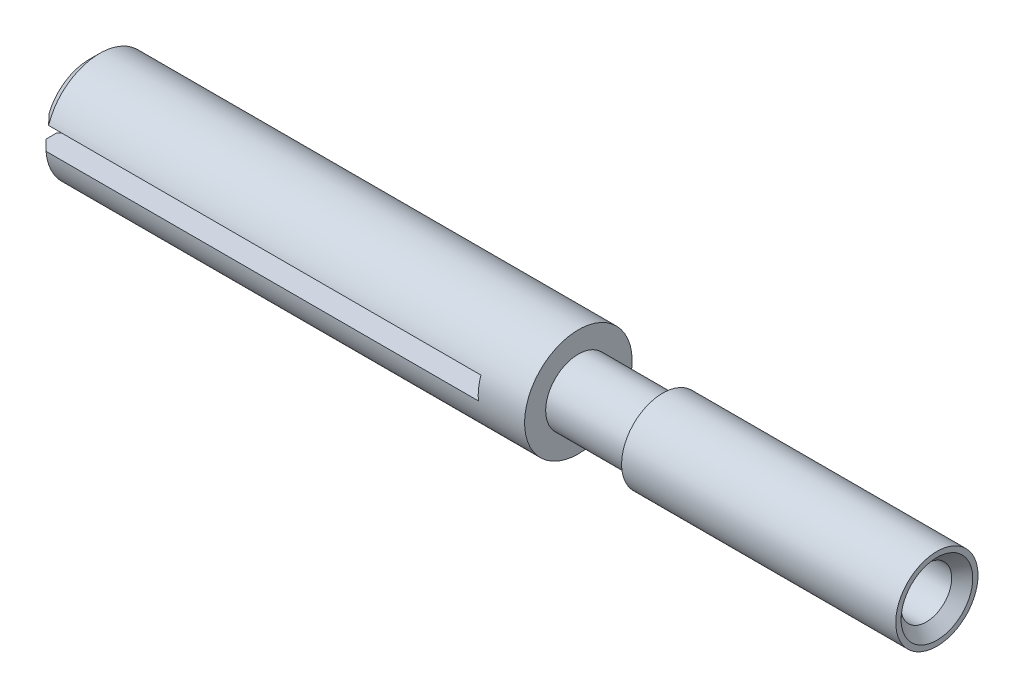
SolidWorks part; units mm, degrees
ref_plane "Plan1" through (0, 0, 0) normal (0, 0, 1) x (1, 0, 0)
ref_plane "Plan2" through (0, 0, 0) normal (0, 1, 0) x (1, 0, 0)
ref_plane "Plan3" through (0, 0, 0) normal (1, 0, 0) x (0, 0, -1)
sketch "Esquisse1" plane through (0, 0, 0) normal (0, 0, 1) x (1, 0, 0)
  line L0 (-28.7, 1.75) -> (-28.7, 1.25)
  line L1 (-5.5, 2.25) -> (-5.5, 1.25)
  line L2 (-5.5, 1.25) -> (-1.5, 1.25)
  line L3 (-1.5, 1.25) -> (-1.5, 1.65)
  line L4 (-1.5, 1.65) -> (-0.6, 1.65)
  line L5 (11.5, 1.65) -> (11.5, 1.4)
  line L6 (11.5, 1.4) -> (11, 0.9)
  line L7 (11, 0.9) -> (0, 0.9)
  line L8 (0, 0.9) -> (-0.5, 0)
  line L9 (-0.5, 0) -> (-6.2, 0)
  line L10 (-28.7, 1.25) -> (-28.2, 0.75)
  line L11 (-28.2, 0.75) -> (-6.7, 0.75)
  line L12 (-6.7, 0.75) -> (-6.2, 0)
  line L13 (-0.6, 1.65) -> (11.5, 1.65)
  line L14 (-57.7, -0.3) -> (56.3, -0.3) construction
  line L15 (-28.2, 2.25) -> (-28.7, 1.75)
  line L16 (-28.2, 2.25) -> (-5.5, 2.25)
  dimension "D13" = 0.5
  dimension "D1" = 4
  dimension "D2" = 0.5
  dimension "D3" = 0.5
  dimension "D4" = 13
  dimension "D5" = 23.2
  dimension "D6" = 12
  dimension "D7" = 0.5
  dimension "D8" = 1.2
  dimension "D9" = 1.95
  dimension "D10" = 1.25
  dimension "D11" = 1.05
  dimension "D12" = 0.5
  dimension "D14" = 2.25
revolve "Base-Révolution" add sketch "Esquisse1" angle 360 about L14
sketch "Esquisse2" plane through (-28.7, 0, 0) normal (-1, 0, 0) x (0, 0, 1)
  line L1 (-3, 0.5) -> (3, 0.5)
  line L2 (-3, 0.5) -> (-3, -0.5)
  line L3 (-3, -0.5) -> (3, -0.5)
  line L4 (3, 0.5) -> (3, -0.5)
  dimension "D1" = 0.5
  dimension "D2" = 1
extrude "Enlèv. mat.-Extru.1" cut sketch "Esquisse2" against normal blind 21
